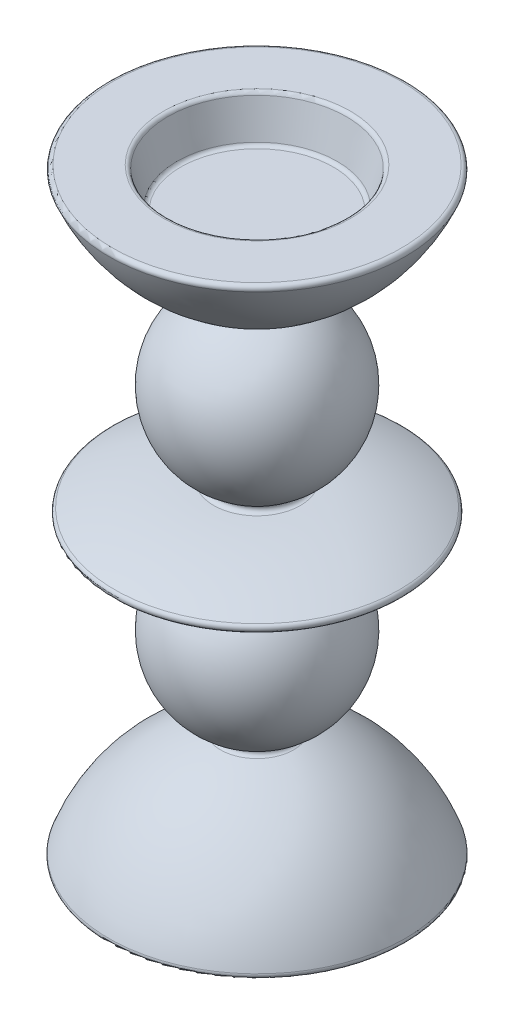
SolidWorks part; units mm, degrees
ref_plane "Front Plane" through (0, 0, 0) normal (0, 0, 1) x (1, 0, 0)
ref_plane "Top Plane" through (0, 0, 0) normal (0, 1, 0) x (1, 0, 0)
ref_plane "Right Plane" through (0, 0, 0) normal (1, 0, 0) x (0, 0, -1)
sketch "MainSketchColumn" plane through (0, 0, 0) normal (0, 0, 1) x (1, 0, 0)
  line L0 (0, 150) -> (37.5, 150)
  line L1 (-37.5, 0) -> (37.5, 0) construction
  line L2 (-37.5, 0) -> (-37.5, 150) construction
  line L3 (-37.5, 150) -> (37.5, 150) construction
  line L4 (37.5, 0) -> (37.5, 150) construction
  line L5 (37.5, 0) -> (0, 0)
  line L6 (0, 0) -> (0, 150) construction
  line L7 (0, 0) -> (0, 150)
  arc A3 (37.5, 150) -> (0, 122) centre (-3.5433, 165.8571) cw
  arc A5 (0, 71) -> (0, 28) centre (0, 49.5) cw
  arc A6 (0, 81) -> (37.5, 75) centre (9.7578, 21.7988) cw
  arc A7 (37.5, 75) -> (0, 71) centre (12.7085, 129.6387) cw
  arc A9 (0, 124) -> (0, 81) centre (0, 102.5) cw
  arc A10 (0, 30) -> (37.5, 0) centre (-4.2829, -13.7911) cw
  point P20 (0, 75)
  dimension "D3" = 43
  dimension "D8" = 28
  dimension "D9" = 2
  dimension "D10" = 2
  dimension "D6" = 21.5
  dimension "D7" = 28
  dimension "D5" = 21.5
  dimension "D11" = 44
  dimension "D12" = 44
  dimension "D13" = 60
  dimension "D14" = 60
  dimension "D1" = 150
  dimension "D2" = 75
  dimension "D4" = 43
ref_plane "Plane1" through (0, 150, 0) normal (0, 1, 0) x (1, 0, 0)
sketch "Sketch1" plane through (0, 0, 0) normal (0, 0, 1) x (1, 0, 0)
  line L0 (0, 0) -> (0, 150) construction
  line L1 (0, 150) -> (37.5, 150) construction
  line L2 (37.5, 0) -> (0, 0) construction
  line L3 (0, 23.1036) -> (0, 150)
  line L4 (0, 150) -> (37.5, 150)
  line L5 (37.5, 0) -> (31.1263, 0)
  line L6 (4.8155, 23.1036) -> (0, 23.1036)
  arc A0 (37.5, 0) -> (0, 30) centre (-4.2829, -13.7911) ccw construction
  arc A1 (0, 28) -> (0, 71) centre (0, 49.5) ccw construction
  arc A2 (0, 71) -> (37.5, 75) centre (12.7085, 129.6387) ccw construction
  arc A3 (37.5, 75) -> (0, 81) centre (9.7578, 21.7988) ccw construction
  arc A4 (0, 81) -> (0, 124) centre (0, 102.5) ccw construction
  arc A5 (0, 122) -> (37.5, 150) centre (-3.5433, 165.8571) ccw construction
  arc A6 (37.5, 0) -> (6.2521, 28.9291) centre (-4.2829, -13.7911) ccw
  arc A7 (6.2521, 28.9291) -> (6.6517, 69.9452) centre (0, 49.5) ccw
  arc A8 (6.6517, 69.9452) -> (37.5, 75) centre (12.7085, 129.6387) ccw
  arc A9 (37.5, 75) -> (5.1243, 81.6196) centre (9.7578, 21.7988) ccw
  arc A10 (5.1243, 81.6196) -> (6.455, 123.0081) centre (0, 102.5) ccw
  arc A11 (6.455, 123.0081) -> (37.5, 150) centre (-3.5433, 165.8571) ccw
  arc A12 (31.1263, 0) -> (4.8155, 23.1036) centre (-4.2829, -13.7911) ccw
  arc A13 (31.8023, -1.8806) -> (4.8155, 23.1036) centre (-4.2829, -13.7911) ccw construction
  dimension "D1" = 6
revolve "Revolve1" add sketch "Sketch1" angle 360 about L3
sketch "Sketch2" plane through (0, 150, 0) normal (0, 1, 0) x (1, 0, 0)
  circle A0 centre (0, 0) radius 22.5
  dimension "D1" = 45
extrude "Cut-Extrude1" cut sketch "Sketch2" against normal blind 10 draft 15
fillet "Fillet1" radius 1
